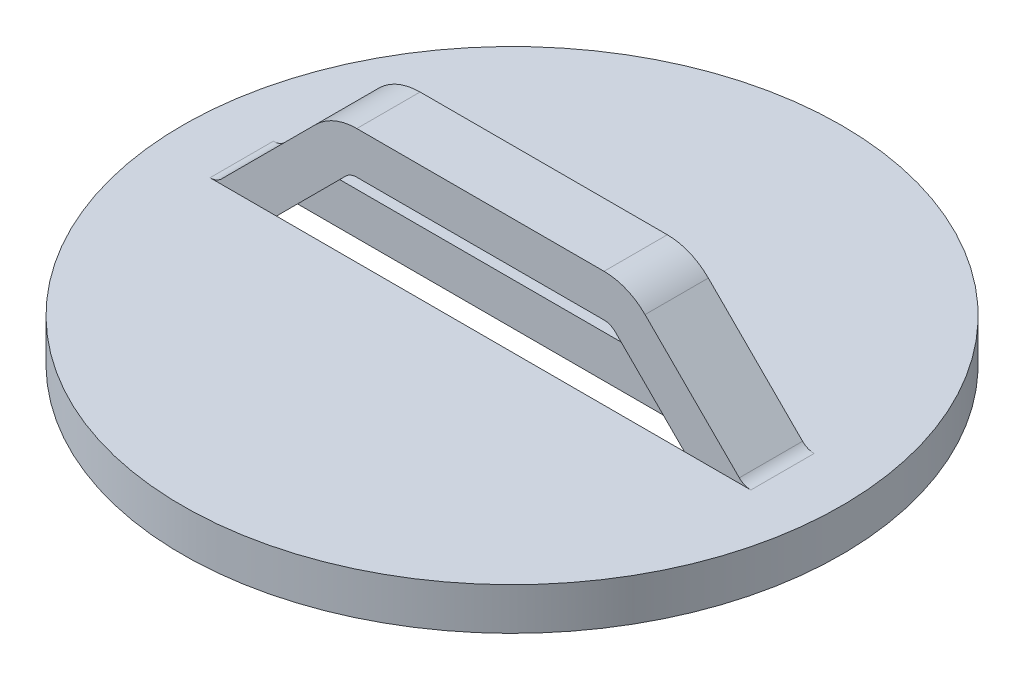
SolidWorks part; units mm, degrees
other "Boss-Extrude1"
ref_plane "Front Plane" through (0, 0, 0) normal (0, 0, 1) x (1, 0, 0)
ref_plane "Top Plane" through (0, 0, 0) normal (0, 1, 0) x (1, 0, 0)
ref_plane "Right Plane" through (0, 0, 0) normal (1, 0, 0) x (0, 0, -1)
imported_body "Imported1"
sketch "Sketch1" plane through (0, -2.032, 0) normal (0, -1, 0) x (1, 0, 0)
  line L0 (0, 0) -> (0, -3.048) construction
  line L1 (5.9547, -3.048) -> (-5.9547, -3.048) construction
  line L3 (-13.0262, 0) -> (13.0262, 0)
  line L4 (-13.0262, 0) -> (-13.0262, -3.048)
  line L5 (-13.0262, -3.048) -> (13.0262, -3.048)
  line L6 (13.0262, 0) -> (13.0262, -3.048)
  line L7 (-13.0262, 0) -> (13.0262, -3.048) construction
  line L8 (-13.0262, -3.048) -> (13.0262, 0) construction
  circle A0 centre (0, -1.524) radius 15.875
  point P5 (0, -1.524)
extrude "Boss-Extrude1" add sketch "Sketch1" against normal up to vertex
other "DeleteFace1"
other "DeleteFace2"
